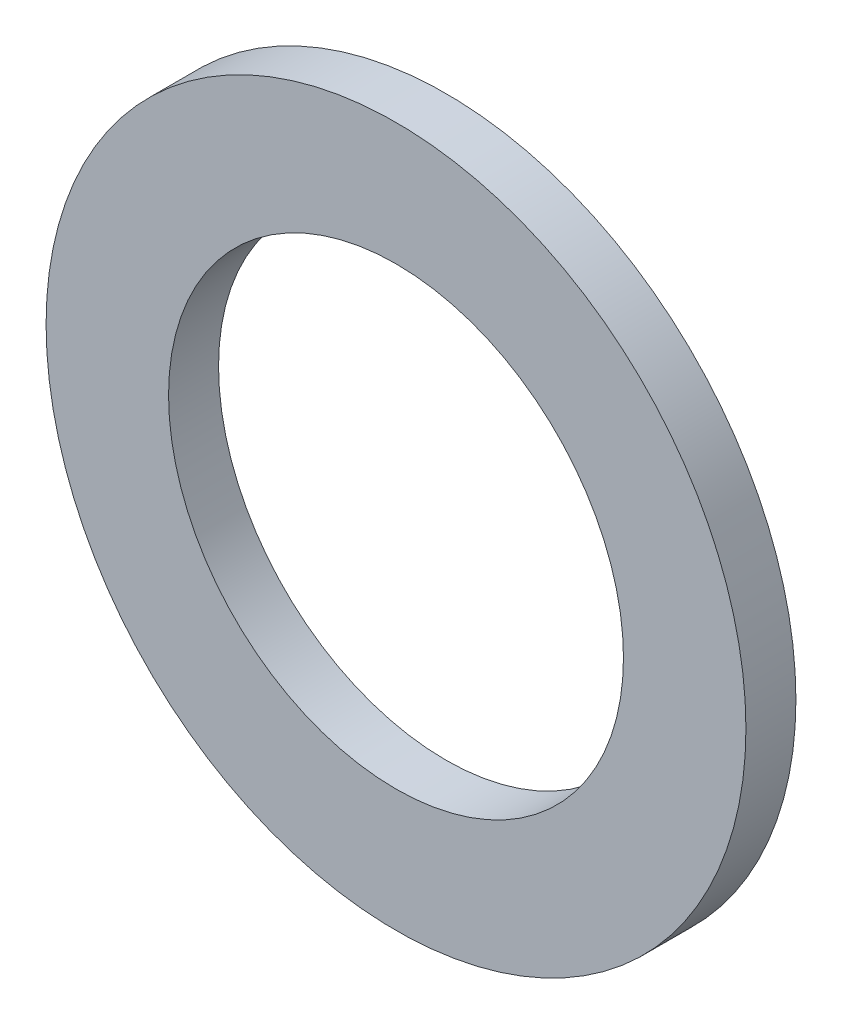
SolidWorks part; units mm, degrees
ref_plane "Plan de face" through (0, 0, 0) normal (0, 0, 1) x (1, 0, 0)
ref_plane "Plan de dessus" through (0, 0, 0) normal (0, 1, 0) x (1, 0, 0)
ref_plane "Plan de droite" through (0, 0, 0) normal (1, 0, 0) x (0, 0, -1)
sketch "Esquisse1" plane through (0, 0, 0) normal (0, 0, 1) x (1, 0, 0)
  circle A0 centre (0, 0) radius 14
  circle A1 centre (0, 0) radius 9.1
  dimension "D1" = 28
  dimension "D2" = 18.2
extrude "Extrusion1" add sketch "Esquisse1" along normal blind 2
